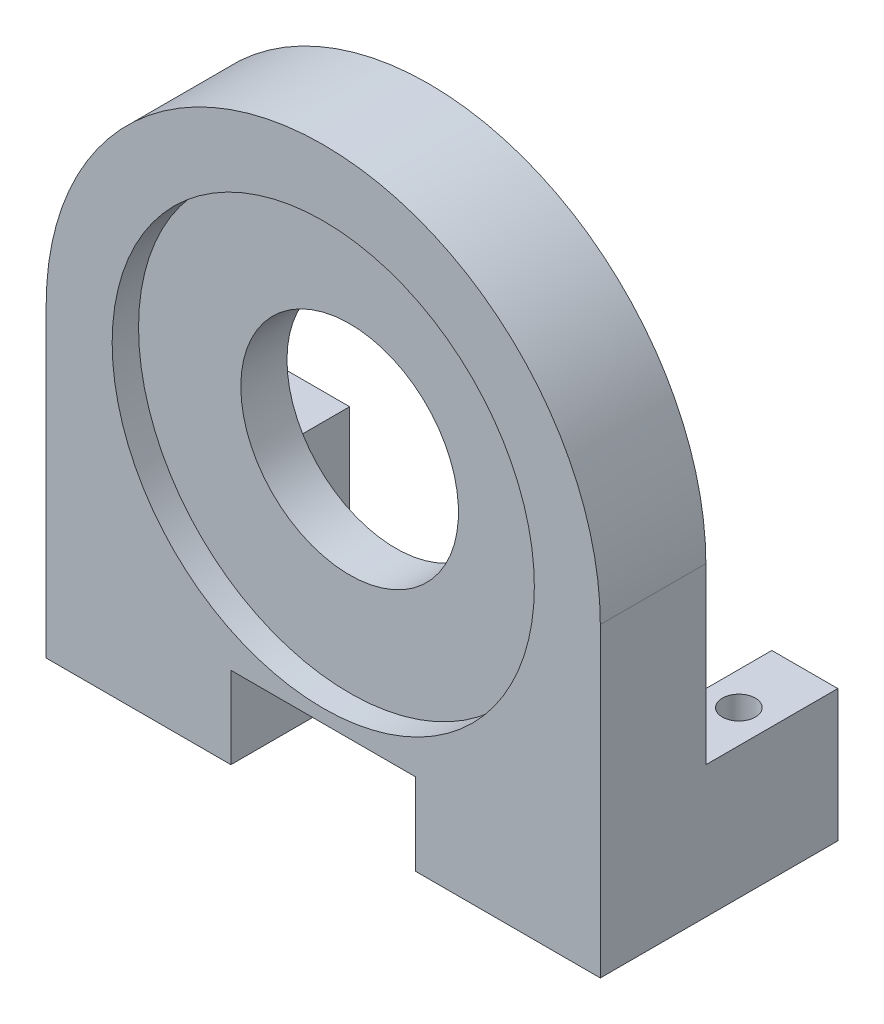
SolidWorks part; units mm, degrees
ref_plane "Front Plane" through (0, 0, 0) normal (0, 0, 1) x (1, 0, 0)
ref_plane "Top Plane" through (0, 0, 0) normal (0, 1, 0) x (1, 0, 0)
ref_plane "Right Plane" through (0, 0, 0) normal (1, 0, 0) x (0, 0, -1)
sketch "Sketch2" plane through (0, 0, 0) normal (0, 0, 1) x (1, 0, 0)
  line L0 (-21, 0) -> (21, 0)
  line L1 (-21, 0) -> (-21, 23.2)
  line L2 (21, 23.2) -> (21, 0)
  circle A1 centre (0, 23.2) radius 16
  arc A3 (-21, 23.2) -> (21, 23.2) centre (0, 23.2) cw
  point P2 (0, 44.2)
  point P5 (0, 0)
  point P7 (0, 0)
  point P8 (0, 0.9)
  point P11 (0, 23.2)
  point P12 (0, 39.2)
  dimension "D1" = 32
  dimension "D4" = 42
extrude "Boss-Extrude1" add sketch "Sketch2" along normal mid plane 8
sketch "Sketch3" plane through (0, 0, 0) normal (0, 0, 1) x (1, 0, 0)
  circle A1 centre (0, 23.2) radius 8.25
  circle A2 centre (0, 23.2) radius 16 construction
  circle A3 centre (0, 23.2) radius 16
  dimension "D1" = 16.5
extrude "Boss-Extrude2" add sketch "Sketch3" against normal blind 1.5 and the other way offset from surface (2 mm away) 2
sketch "Sketch6" plane through (0, 0, -4) normal (0, 0, -1) x (-1, 0, 0)
  line L0 (0, 18.7908) -> (0, -15.548) construction
  line L1 (-21, 0) -> (-16, 0)
  line L2 (-21, 0) -> (-21, 10)
  line L3 (-21, 10) -> (-16, 10)
  line L4 (-16, 0) -> (-16, 10)
  line L5 (21, 0) -> (21, 10)
  line L6 (21, 0) -> (16, 0)
  line L7 (16, 0) -> (16, 10)
  line L8 (21, 10) -> (16, 10)
  dimension "D1" = 5
  dimension "D2" = 10
extrude "Boss-Extrude4" add sketch "Sketch6" along normal blind 10
sketch "Sketch7" plane through (0, 0, 0) normal (0, -1, 0) x (1, 0, 0)
  line L0 (0, 9.1446) -> (0, -14.4574) construction
  line L1 (-16, -14) -> (-21, -14) construction
  line L2 (-21, 4) -> (-21, -14) construction
  line L3 (-21, 4) -> (21, 4) construction
  circle A0 centre (-18.5, -9) radius 1.25
  circle A1 centre (18.5, -9) radius 1.25
  circle A2 centre (-18.5, -1) radius 1.25
  circle A3 centre (18.5, -1) radius 1.25
  dimension "D1" = 2.5
  dimension "D4" = 5
  dimension "D2" = 5
  dimension "D3" = 2.5
extrude "Cut-Extrude2" cut sketch "Sketch7" against normal up to surface (10 mm away)
sketch "Sketch8" plane through (0, 0, -4) normal (0, 0, -1) x (-1, 0, 0)
  line L0 (-7, -6.2) -> (-7, 6.2)
  line L1 (-7, -6.2) -> (7, -6.2)
  line L2 (-7, 6.2) -> (7, 6.2)
  line L3 (7, -6.2) -> (7, 6.2)
  line L4 (-7, -6.2) -> (7, 6.2) construction
  line L5 (-7, 6.2) -> (7, -6.2) construction
  circle A0 centre (0, 23.2) radius 16 construction
  point P0 (0, 7.2)
  point P9 (0, 0)
  dimension "D1" = 1
  dimension "D2" = 14
extrude "Cut-Extrude3" cut sketch "Sketch8" against normal through all
